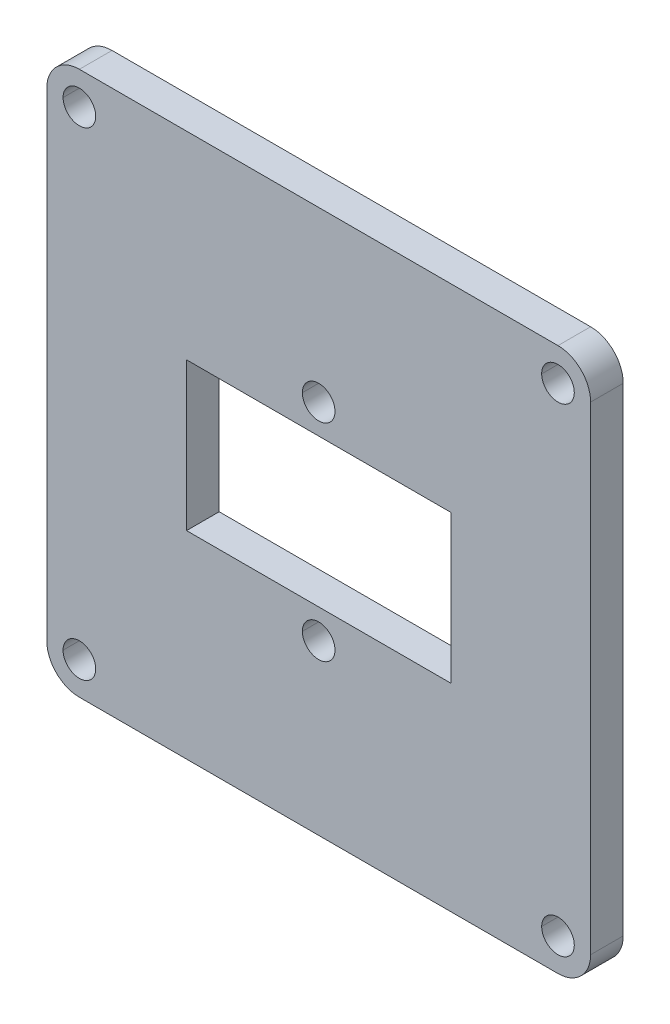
SolidWorks part; units mm, degrees
ref_plane "Front Plane" through (0, 0, 0) normal (0, 0, 1) x (1, 0, 0)
ref_plane "Top Plane" through (0, 0, 0) normal (0, 1, 0) x (1, 0, 0)
ref_plane "Right Plane" through (0, 0, 0) normal (1, 0, 0) x (0, 0, -1)
imported_body "Imported1"
sketch "Sketch1" plane through (0, 0, 0) normal (0, 0, 1) x (1, 0, 0)
  line L1 (35.04, -78.82) -> (59.34, -78.82)
  line L2 (35.04, -78.82) -> (35.04, -92.42)
  line L3 (35.04, -92.42) -> (59.34, -92.42)
  line L4 (59.34, -78.82) -> (59.34, -92.42)
extrude "Cut-Extrude1" cut sketch "Sketch1" along normal blind 3
